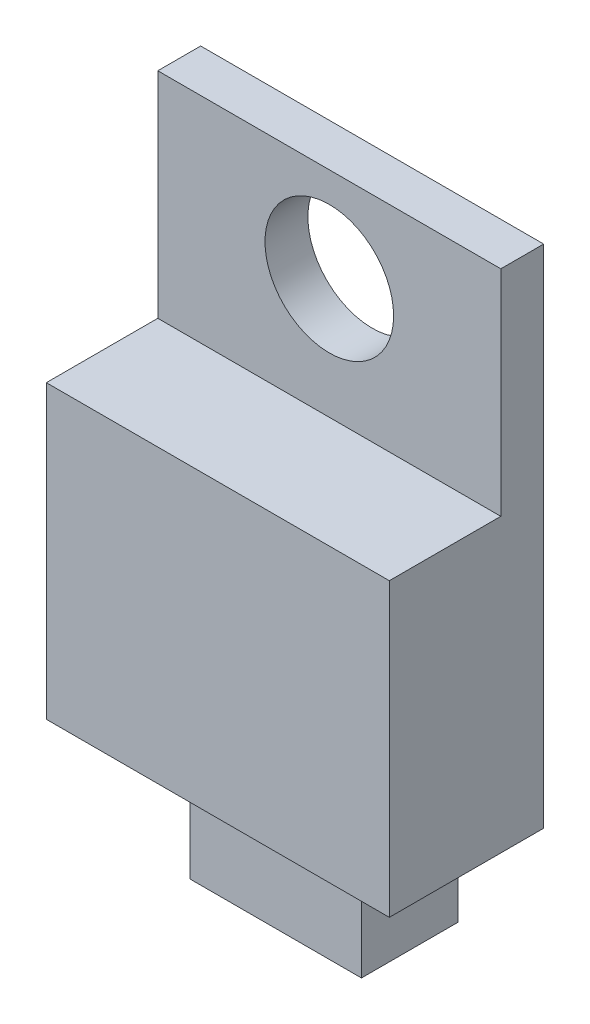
SolidWorks part; units mm, degrees
ref_plane "Front Plane" through (0, 0, 0) normal (0, 0, 1) x (1, 0, 0)
ref_plane "Top Plane" through (0, 0, 0) normal (0, 1, 0) x (1, 0, 0)
ref_plane "Right Plane" through (0, 0, 0) normal (1, 0, 0) x (0, 0, -1)
sketch "Sketch1" plane through (0, 0, 0) normal (0, 0, 1) x (1, 0, 0)
  line L0 (5.08, 14.986) -> (5.08, 0) construction
  line L1 (0, 0) -> (10.16, 0)
  line L2 (0, 0) -> (0, 14.986)
  line L3 (0, 14.986) -> (10.16, 14.986)
  line L4 (10.16, 0) -> (10.16, 14.986)
  circle A0 centre (5.08, 12.192) radius 1.905
  dimension "D3" = 3.81
  dimension "D1" = 14.986
  dimension "D2" = 10.16
  dimension "D4" = 2.794
extrude "Extrude1" add sketch "Sketch1" along normal blind 1.27
sketch "Sketch2" plane through (0, 0, 1.27) normal (0, 0, 1) x (1, 0, 0)
  line L1 (0, 0) -> (10.16, 0)
  line L2 (0, 0) -> (0, 8.636)
  line L3 (0, 8.636) -> (10.16, 8.636)
  line L4 (10.16, 0) -> (10.16, 8.636)
  line L5 (10.16, 0) -> (10.16, 14.986) construction
  dimension "D1" = 8.636
extrude "Extrude2" add sketch "Sketch2" along normal blind 3.302
sketch "Sketch3" plane through (0, 0, 0) normal (0, -1, 0) x (1, 0, 0)
  line L0 (5.08, 4.572) -> (5.08, 0) construction
  line L1 (0, 4.572) -> (10.16, 4.572) construction
  line L2 (0, 0) -> (10.16, 0) construction
  line L4 (5.5641, -1.1987) -> (5.5915, -1.2079) construction
  line L5 (2.54, 0) -> (7.62, 0)
  line L6 (2.54, 0) -> (2.54, 2.8575)
  line L7 (2.54, 2.8575) -> (7.62, 2.8575)
  line L8 (7.62, 0) -> (7.62, 2.8575)
  dimension "D1" = 5.08
  dimension "D2" = 2.8575
  dimension "D3" = 2.54
extrude "Extrude3" add sketch "Sketch3" along normal blind 3.683
